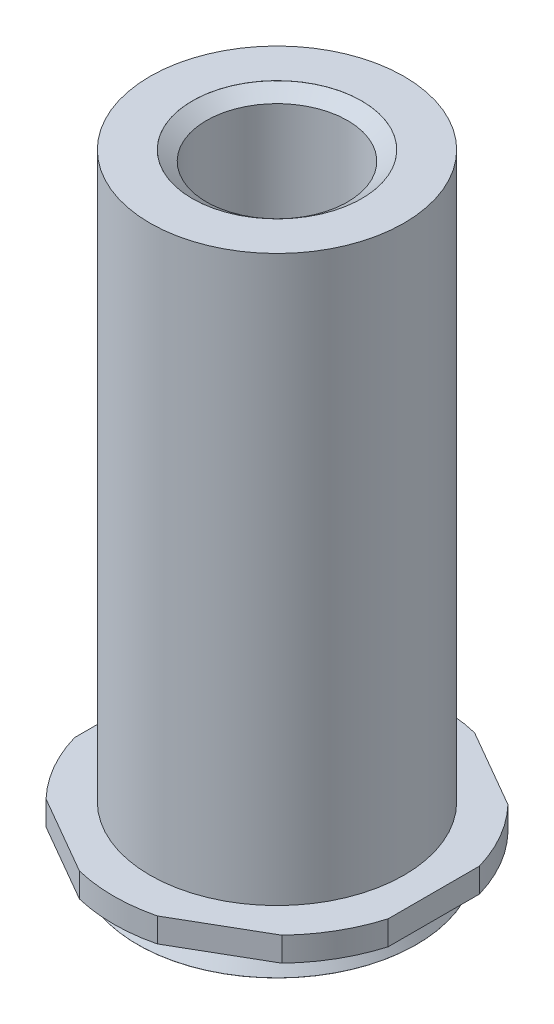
SolidWorks part; units mm, degrees
ref_plane "Plane1" through (0, 0, 0) normal (0, 0, 1) x (1, 0, 0)
ref_plane "Plane2" through (0, 0, 0) normal (0, 1, 0) x (1, 0, 0)
ref_plane "Plane3" through (0, 0, 0) normal (1, 0, 0) x (0, 0, -1)
sketch "BodySke" plane through (0, 0, 0) normal (0, 0, 1) x (1, 0, 0)
  line L0 (4.5006, 0) -> (5.7851, 0)
  line L1 (5.7851, 0) -> (5.7851, 0.8595)
  line L2 (5.7851, 0.8595) -> (4.5, 0.8595)
  line L3 (2.5, 20.8595) -> (2.5, 11.2595)
  line L4 (0, -1.0505) -> (4.94, -1.0505)
  line L5 (4.94, -1.0505) -> (4.94, -1.0475)
  line L6 (4.94, -1.0475) -> (4.5006, -0.2865)
  line L7 (1.016, 19.8595) -> (3.6522, 19.8595) construction
  line L8 (4.5, 20.8595) -> (2.5, 20.8595)
  line L9 (0, 0) -> (0, 15.24) construction
  line L10 (4.5006, -0.2865) -> (4.5006, 0)
  line L11 (4.5, 20.8595) -> (4.5, 0.8595)
  line L12 (0, 11.2595) -> (2.5, 11.2595)
  line L13 (0, 11.2595) -> (0, -1.0505)
  line L14 (1.016, 11.2595) -> (3.6522, 11.2595) construction
  line L15 (1.016, 11.2595) -> (3.6522, 11.2595) construction
  dimension "D1" = 60
  dimension "E_dia" = 11.5702
  dimension "C_dia" = 9.88
  dimension "A_ht" = 1.0505
  dimension "Thread_min" = 5
  dimension "C_len" = 0.003
  dimension "Clinching_ht" = 0.2865
  dimension "Advance" = 1
  dimension "Thickness" = 1.91
  dimension "B_dia" = 9
  dimension "Length" = 20
  dimension "Thread_limit" = 9.6
  dimension "Thread_depth" = 9.6
  dimension "Drill_depth" = 9.6
revolve "Body" add sketch "BodySke"
revolve "EndChamfer" cut sketch "EndChamferSke" angle 360 about L0
sketch "EndChamferSke" plane through (0, 0, 0) normal (0, 0, 1) x (1, 0, 0)
  line L0 (0, -2.54) -> (0, 7.62) construction
  line L1 (0, 0) -> (0, 15.24) construction
  line L6 (3, 20.857) -> (2.5, 20.507)
  line L7 (3, 20.857) -> (3, 21.1135)
  line L8 (2.5, 20.507) -> (2.5, 21.1135)
  line L9 (3, 21.1135) -> (2.5, 21.1135)
  line L10 (4.5, 20.8595) -> (-4.5, 20.8595) construction
  dimension "D1" = 0.254
  dimension "Thread_nominal" = 6
  dimension "D2" = 34.99
  dimension "Thread_min" = 5
  dimension "Inset" = 0.0025
revolve "TapDrill" cut sketch "TapDriSke" angle 360 about L0
sketch "TapDriSke" plane through (0, 0, 0) normal (0, 0, 1) x (1, 0, 0)
  line L0 (0, 0) -> (0, 15.24) construction
  line L1 (0, 0) -> (0, 15.24) construction
  line L2 (2.5, 6.2595) -> (2.5, 20.8595)
  line L3 (4.5, 20.8595) -> (-4.5, 20.8595) construction
  line L4 (2.5, 6.2595) -> (0, 5.224)
  line L5 (0, 5.224) -> (0, 20.8595)
  line L6 (0, 20.8595) -> (2.5, 20.8595)
  line L7 (2.5, 11.2595) -> (2.5, 20.8595) construction
  line L8 (0, 5.224) -> (-2.5, 6.2595) construction
  line L9 (-2.5, 20.8595) -> (-2.5, 11.2595) construction
  dimension "D1" = 135
  dimension "Depth" = 14.6
ref_plane "Plane4" through (0, -0.5486, 0) normal (0, 1, 0) x (-1, 0, 0)
sketch "ThdSchSke" plane through (0, 0, 0) normal (0, 0, 1) x (1, 0, 0)
  line L0 (0, -5.08) -> (0, 7.62) construction
  line L1 (0, 0) -> (0, 15.24) construction
  line L2 (0, 20.857) -> (3, 20.857) construction
  line L3 (3, 20.857) -> (-3, 20.857) construction
  line L4 (3, 20.857) -> (2.5, 21.2071)
  line L6 (3, 20.857) -> (2.5, 20.5069)
  line L7 (2.5, 21.2071) -> (2.5, 20.5069)
  dimension "Vee_angle" = 70
  dimension "Thread_nominal" = 6
  dimension "Thread_min" = 5
revolve "ThreadSchematic" [suppressed] cut sketch "ThdSchSke" angle 360 about L0
pattern_linear "ThdSchPat" [suppressed]
sketch "HexDieSke" plane through (0, 0.8595, 0) normal (0, 1, 0) x (-1, 0, 0)
  line L0 (0, 6.4144) -> (5.555, 3.2072)
  line L1 (5.555, 3.2072) -> (5.555, -3.2072)
  line L2 (5.555, -3.2072) -> (0, -6.4144)
  line L3 (0, -6.4144) -> (-5.555, -3.2072)
  line L4 (-5.555, -3.2072) -> (-5.555, 3.2072)
  line L5 (-5.555, 3.2072) -> (0, 6.4144)
  circle A1 centre (0, 0) radius 5.555 construction
  circle A2 centre (0, 0) radius 6.4144 construction
  circle A3 centre (0, 0) radius 6.4443
  dimension "Width_across_flats" = 11.11
  dimension "OD" = 12.8886
extrude "HexDie" cut sketch "HexDieSke" against normal blind 0.8595
equation "' \"Length@BodySke\" = 20"
equation "' \"Thickness@BodySke\" = 1.91"
equation "' \"B_dia@BodySke\" = 9"
equation "' \"C_dia@BodySke\" = 9.88"
equation "' \"Width_across_flats@HexDieSke\" = 11.11"
equation "' \"E_dia@BodySke\" = \"Width_across_flats@HexDieSke\" * 1.04 ' varies by type (1.04 or 1.16)"
equation "' \"Thread_depth@BodySke\" = 9.6"
equation "' \"Drill_depth@BodySke\" = 9.6"
equation "' \"Advance@BodySke\" = 1"
equation "' \"Thread_min@BodySke\" = 5"
equation "' \"Thread_nominal@ThreadCosmetic\" = 6"
equation "\"Thread_limit@BodySke\" = ((sgn( \"Length@BodySke\" - \"Thread_depth@BodySke\" )-1)*( \"Length@BodySke\" - \"Thread_depth@BodySke\" ))/-2+ \"Thread_depth@BodySke\""
equation "\"Depth@TapDriSke\" = \"Thread_limit@BodySke\" + \"Advance@BodySke\" * 5"
equation "\"Depth@TapDriSke\" = ((sgn( \"Depth@TapDriSke\" - \"Drill_depth@BodySke\" )+1)*( \"Depth@TapDriSke\" - \"Drill_depth@BodySke\" ))/2 +\"Drill_depth@BodySke\""
equation "\"A_ht@BodySke\" = \"Thickness@BodySke\" * 0.55"
equation "\"Clinching_ht@BodySke\" = \"Thickness@BodySke\" * 0.15"
equation "\"C_len@BodySke\" =  0.003"
equation "\"Depth@HexDie\" = \"Thickness@BodySke\" - \"A_ht@BodySke\""
equation "\"OD@HexDieSke\" =  \"Width_across_flats@HexDieSke\" * 1.16 + 0.001"
equation "\"Thread_nominal@EndChamferSke\" = \"Thread_nominal@ThreadCosmetic\""
equation "\"Thread_min@EndChamferSke\" = \"Thread_min@BodySke\""
equation "\"D2@EndChamferSke\" = \"Vee_angle@ThdSchSke\" / 2 - 0.01"
equation "\"Thread_nominal@ThdSchSke\" = \"Thread_nominal@ThreadCosmetic\""
equation "\"Thread_min@ThdSchSke\" = \"Thread_min@BodySke\""
equation "\"Num_threads@ThdSchPat\" = int(  ( \"Thread_limit@BodySke\" - \"Inset@EndChamferSke\" ) / \"Advance@BodySke\" + 0.999 )  + 1"
equation "\"Advance@ThdSchPat\" = (  \"Thread_limit@BodySke\" - \"Inset@EndChamferSke\" ) /  (\"Num_threads@ThdSchPat\" - 1) 'relax it"
